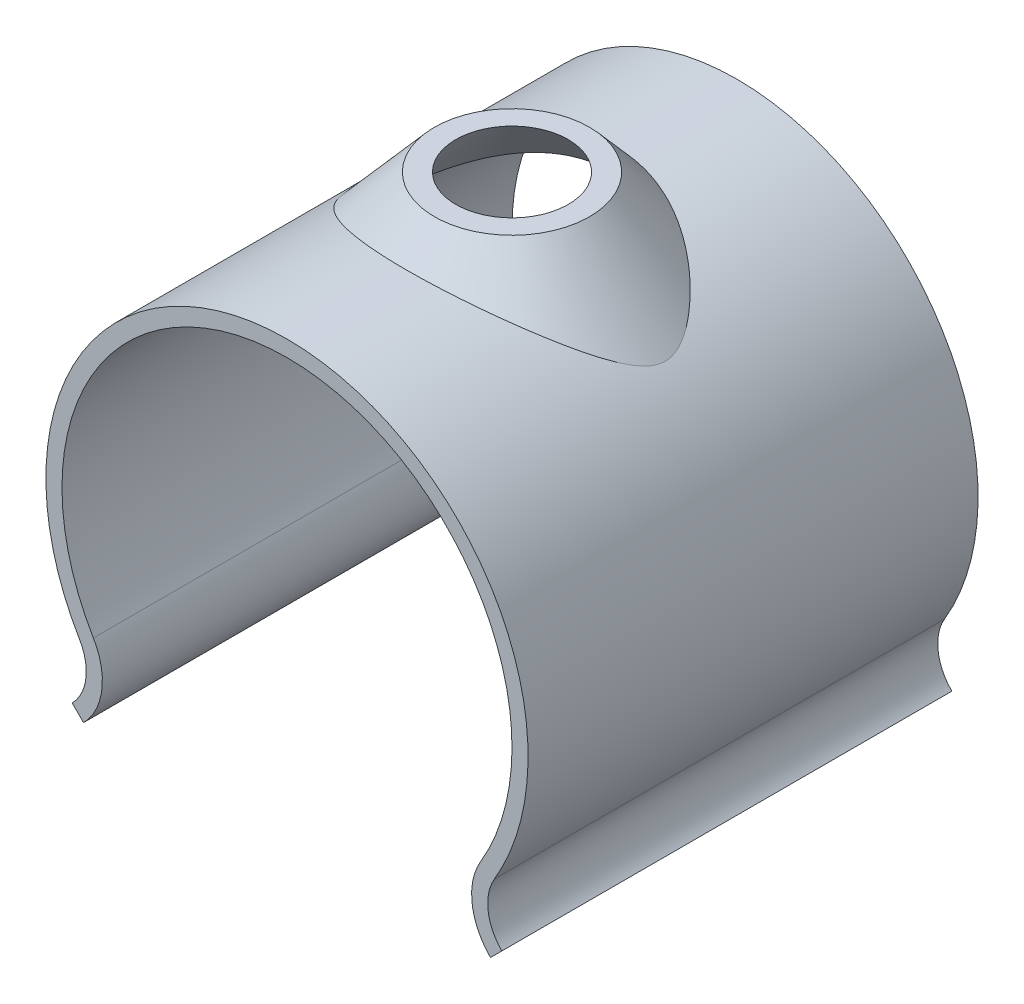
SolidWorks part; units mm, degrees
ref_plane "Спереди" through (0, 0, 0) normal (0, 0, 1) x (1, 0, 0)
ref_plane "Сверху" through (0, 0, 0) normal (0, 1, 0) x (1, 0, 0)
ref_plane "Справа" through (0, 0, 0) normal (1, 0, 0) x (0, 0, -1)
sketch "Эскиз1" plane through (0, 0, 0) normal (0, 0, 1) x (1, 0, 0)
  line L0 (-10.0486, -9.525) -> (-10.6099, -8.9637)
  line L1 (10.0486, -9.525) -> (10.6099, -8.9637)
  line L2 (0, -22.413) -> (0, 31.9833) construction
  line L3 (-10.6099, -8.9637) -> (-12.283, -10.6369) construction
  arc A0 (10.2448, -6.0666) -> (-10.2448, -6.0666) centre (0, 0) ccw
  arc A1 (9.5618, -5.6622) -> (-9.5618, -5.6622) centre (0, 0) ccw
  arc A2 (-10.2448, -6.0666) -> (-10.6099, -8.9637) centre (-12.2937, -7.2799) cw
  arc A3 (-10.0486, -9.525) -> (-9.5618, -5.6622) centre (-12.2937, -7.2799) ccw
  arc A4 (9.5618, -5.6622) -> (10.0486, -9.525) centre (12.2937, -7.2799) ccw
  arc A5 (10.2448, -6.0666) -> (10.6099, -8.9637) centre (12.2937, -7.2799) ccw
  dimension "D1" = 0.7937
  dimension "D2" = 11.9062
  dimension "D4" = 2.3813
  dimension "D3" = 45
  dimension "D5" = 9.525
extrude "Бобышка-Вытянуть1" add sketch "Эскиз1" along normal mid plane 22.225
sketch "Эскиз2" plane through (0, 0, 0) normal (0, 0, 1) x (1, 0, 0)
  line L0 (0, 0) -> (0, 11.9062) construction
  line L1 (0, 9.1865) -> (0, 13.4937)
  line L2 (0, 13.4937) -> (-3.8299, 13.4937)
  line L3 (-3.8299, 13.4937) -> (-7.5741, 9.1865)
  line L4 (-7.5741, 9.1865) -> (0, 9.1865)
  line L6 (-2.7781, 13.4937) -> (-5.2755, 10.6209) construction
  arc A1 (10.2448, -6.0666) -> (-10.2448, -6.0666) centre (0, 0) ccw construction
  dimension "D1" = 0.7937
  dimension "D2" = 41
  dimension "D3" = 1.5875
  dimension "D4" = 5.5562
revolve "Повернуть1" add sketch "Эскиз2" angle 360 about L0
sketch "Эскиз3" plane through (0, 0, 11.1125) normal (0, 0, 1) x (1, 0, 0)
  circle A0 centre (0, 0) radius 11.1125
  arc A1 (9.5618, -5.6622) -> (-9.5618, -5.6622) centre (0, 0) ccw construction
extrude "Вырез-Вытянуть1" cut sketch "Эскиз3" against normal through all
sketch "Эскиз4" plane through (0, 0, 0) normal (0, 0, 1) x (1, 0, 0)
  line L0 (0, 0) -> (0, 16.7562) construction
  line L1 (0, 8.6152) -> (-7.019, 8.6152)
  line L2 (-7.019, 8.6152) -> (-2.7781, 13.4937)
  line L3 (-2.7781, 13.4937) -> (0, 13.4937)
  line L4 (0, 13.4937) -> (0, 8.6152)
  line L5 (3.8299, 13.4937) -> (-3.8299, 13.4937) construction
  arc A0 (9.5618, -5.6622) -> (-9.5618, -5.6622) centre (0, 0) ccw construction
  dimension "D1" = 41
  dimension "D2" = 5.5562
revolve "Вырез-Повернуть1" cut sketch "Эскиз4" angle 360 about L0
